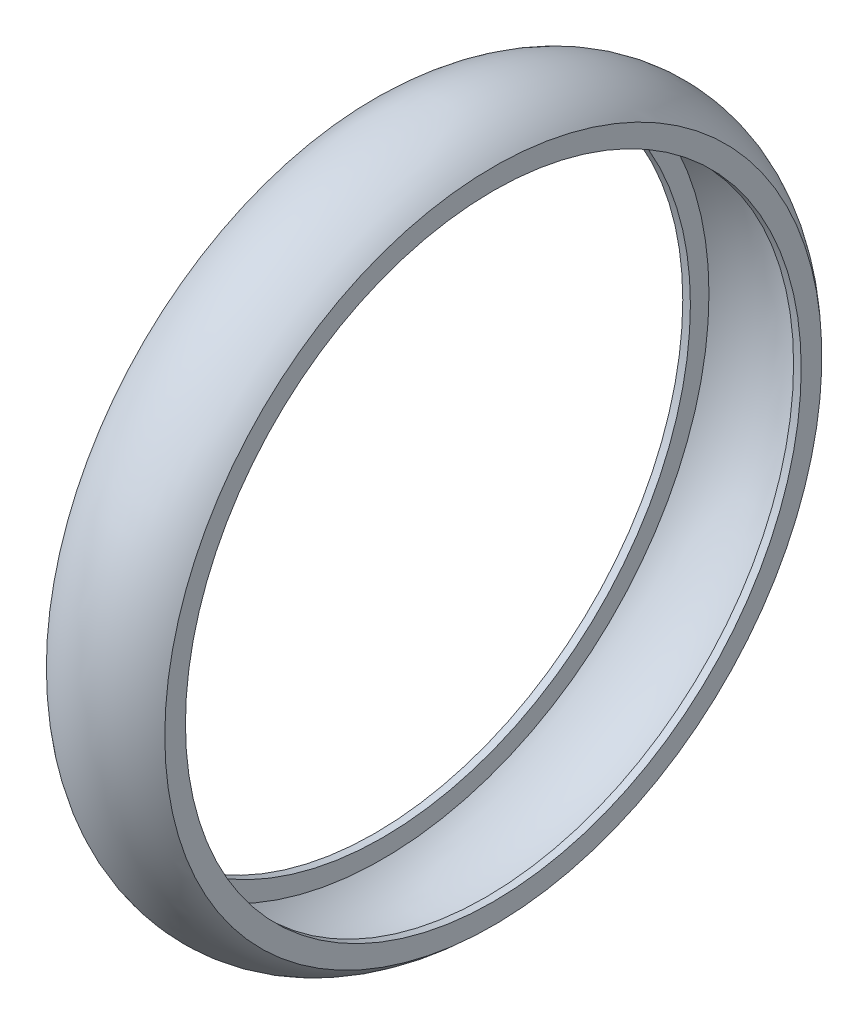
SolidWorks part; units mm, degrees
ref_plane "Plan de face" through (0, 0, 0) normal (0, 0, 1) x (1, 0, 0)
ref_plane "Plan de dessus" through (0, 0, 0) normal (0, 1, 0) x (1, 0, 0)
ref_plane "Plan de droite" through (0, 0, 0) normal (1, 0, 0) x (0, 0, -1)
sketch "Esquisse1" plane through (0, 0, 0) normal (0, 0, 1) x (1, 0, 0)
  line L0 (0, 0) -> (0, -2)
  line L1 (5, -31.8347) -> (17.7013, -31.8347) construction
  line L2 (0, -2) -> (0.7383, -2)
  line L3 (0.7383, -2) -> (0.7383, -0.2)
  line L4 (5.7383, -1.8347) -> (5.7383, 5.2903) construction
  line L5 (10.7383, -2) -> (10.7383, -0.2)
  line L6 (11.4766, -2) -> (10.7383, -2)
  line L7 (11.4766, 0) -> (11.4766, -2)
  arc A0 (0, 0) -> (11.4766, 0) centre (5.7383, -5.7383) cw
  arc A1 (0.7383, -0.2) -> (10.7383, -0.2) centre (5.7383, -6.3257) cw
  dimension "D1" = 2
  dimension "D2" = 1.8
  dimension "D3" = 10
  dimension "D4" = 30
revolve "Révolution2" add sketch "Esquisse1" angle 360 about L1
